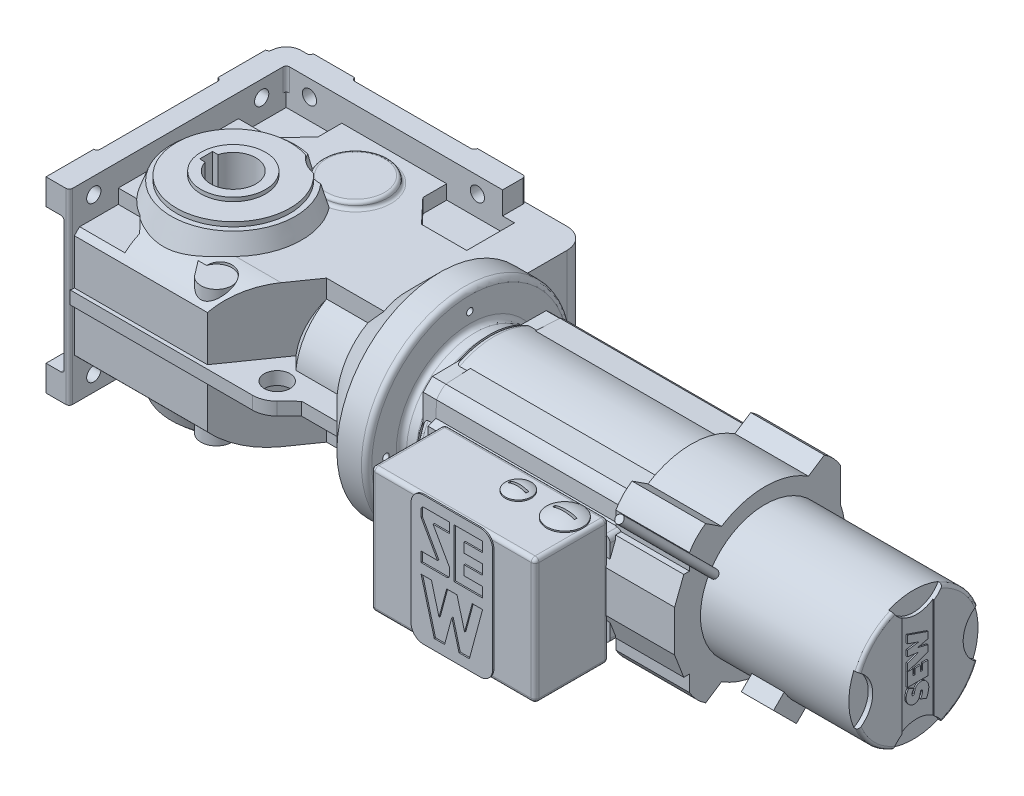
SolidWorks part; units mm, degrees
ref_plane "Frontal" through (0, 0, 0) normal (0, 0, 1) x (1, 0, 0)
ref_plane "Horizontal" through (0, 0, 0) normal (0, 1, 0) x (1, 0, 0)
ref_plane "Vertical" through (0, 0, 0) normal (1, 0, 0) x (0, 0, -1)
imported_body "Importée1"
other "SupprimerFace1"
sketch "Esquisse1" plane through (0, 0, 0) normal (0, 1, 0) x (1, 0, 0)
  line L0 (0, 0) -> (-38.3434, 0) construction
  line L2 (-21, -5) -> (4.0085, -5)
  line L3 (-21, -5) -> (-21, 5)
  line L4 (-21, 5) -> (4.0085, 5)
  line L5 (4.0085, -5) -> (4.0085, 5)
  line L6 (-21, -5) -> (4.0085, 5) construction
  line L7 (-21, 5) -> (4.0085, -5) construction
  point P3 (-8.4958, 0)
  dimension "D1" = 10
  dimension "D2" = 21
extrude "Extrusion1" cut sketch "Esquisse1" along normal through all and the other way through all
